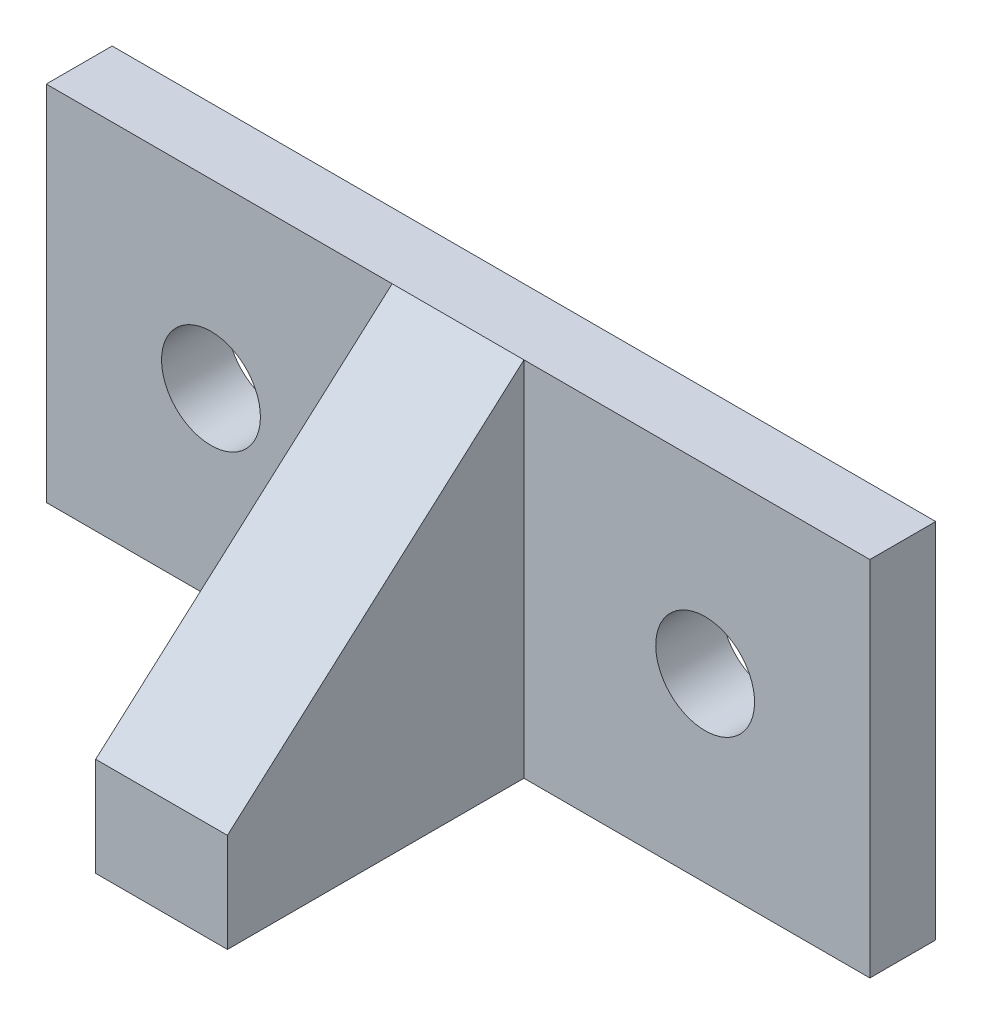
SolidWorks part; units mm, degrees
ref_plane "Front Plane" through (0, 0, 0) normal (0, 0, 1) x (1, 0, 0)
ref_plane "Top Plane" through (0, 0, 0) normal (0, 1, 0) x (1, 0, 0)
ref_plane "Right Plane" through (0, 0, 0) normal (1, 0, 0) x (0, 0, -1)
sketch "Sketch1" plane through (0, 0, 0) normal (0, 0, 1) x (1, 0, 0)
  line L1 (-62.5, -27.5) -> (62.5, -27.5)
  line L2 (-62.5, -27.5) -> (-62.5, 27.5)
  line L3 (-62.5, 27.5) -> (62.5, 27.5)
  line L4 (62.5, -27.5) -> (62.5, 27.5)
  line L5 (-62.5, -27.5) -> (62.5, 27.5) construction
  line L6 (-62.5, 27.5) -> (62.5, -27.5) construction
  circle A0 centre (-37.5, 0) radius 7.5
  circle A1 centre (37.5, 0) radius 7.5
  point P0 (0, 0)
  dimension "D3" = 15
  dimension "D4" = 15
  dimension "D1" = 125
  dimension "D2" = 55
  dimension "D5" = 37.5
  dimension "D6" = 37.5
extrude "Boss-Extrude1" add sketch "Sketch1" along normal blind 55
sketch "Sketch2" plane through (62.5, 0, 0) normal (1, 0, 0) x (0, 0, -1)
  line L0 (-55, -27.5) -> (-55, 27.5)
  line L1 (-55, -27.5) -> (-55, 27.5) construction
  line L2 (-55, 27.5) -> (-10, 27.5)
  line L3 (-55, 27.5) -> (0, 27.5) construction
  line L4 (-10, 27.5) -> (-10, -27.5)
  line L5 (-55, -27.5) -> (0, -27.5) construction
  line L6 (-10, -27.5) -> (-55, -27.5)
  dimension "D1" = 10
extrude "Cut-Extrude4" cut sketch "Sketch2" against normal blind 52.5
sketch "Sketch3" plane through (-62.5, 0, 0) normal (-1, 0, 0) x (0, 0, 1)
  line L0 (55, -27.5) -> (55, 27.5)
  line L1 (55, 27.5) -> (10, 27.5)
  line L2 (55, 27.5) -> (0, 27.5) construction
  line L3 (10, 27.5) -> (10, -27.5)
  line L4 (55, -27.5) -> (0, -27.5) construction
  line L5 (10, -27.5) -> (55, -27.5)
  dimension "D1" = 10
extrude "Cut-Extrude5" cut sketch "Sketch3" against normal blind 52.5
sketch "Sketch4" plane through (10, 0, 0) normal (1, 0, 0) x (0, 0, -1)
  line L0 (-55, 27.5) -> (-55, -12.5)
  line L1 (-55, 27.5) -> (-55, -27.5) construction
  line L2 (-55, -12.5) -> (-10, 27.5)
  line L3 (-10, 27.5) -> (-55, 27.5)
  dimension "D1" = 15
extrude "Cut-Extrude6" cut sketch "Sketch4" against normal through all
